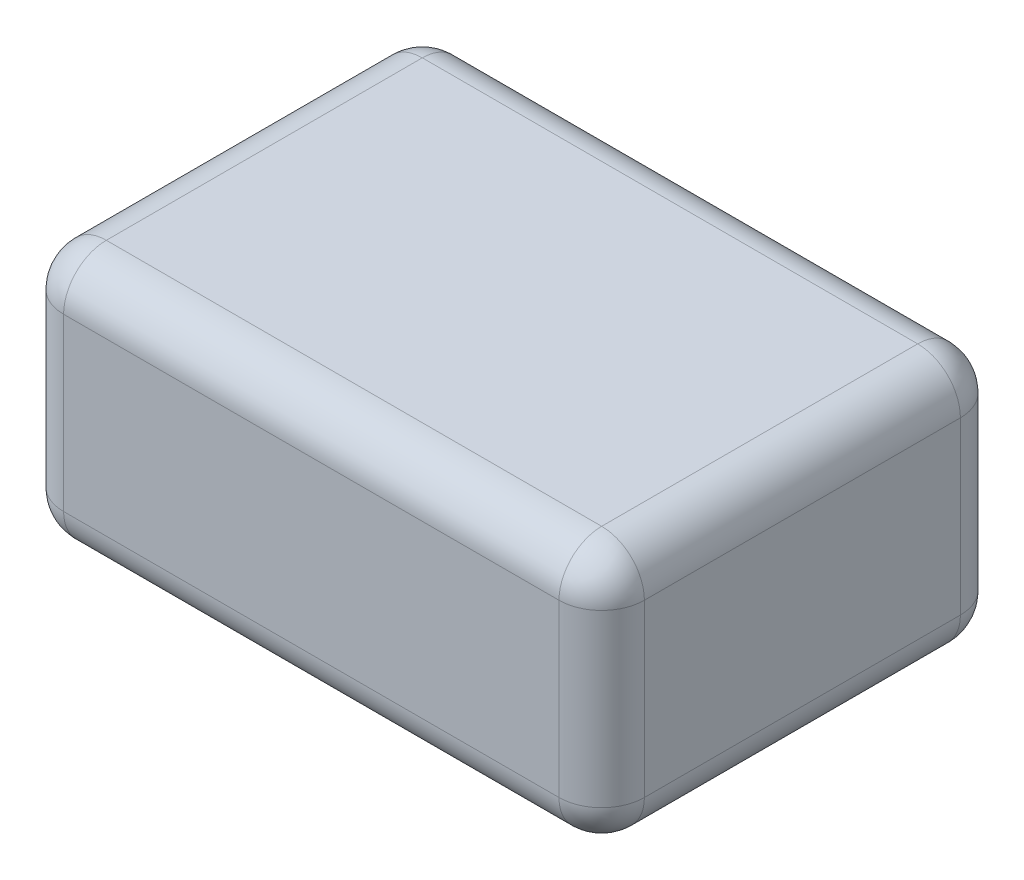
SolidWorks part; units mm, degrees
ref_plane "Plan de face" through (0, 0, 0) normal (0, 0, 1) x (1, 0, 0)
ref_plane "Plan de dessus" through (0, 0, 0) normal (0, 1, 0) x (1, 0, 0)
ref_plane "Plan de droite" through (0, 0, 0) normal (1, 0, 0) x (0, 0, -1)
sketch "Esq_plaque" plane through (0, 0, 0) normal (0, 0, 1) x (1, 0, 0)
  line L1 (0, 0) -> (68, 0)
  line L2 (0, 0) -> (0, 30)
  line L3 (0, 30) -> (68, 30)
  line L4 (68, 0) -> (68, 30)
  dimension "larg" = 30
  dimension "long" = 68
extrude "plaque" add sketch "Esq_plaque" along normal blind 47
fillet "Congé_pièce" radius 5 12 edges at (0, 0, 23.5) (68, 0, 23.5) (68, 30, 23.5) (0, 30, 23.5) (34, 30, 47) (68, 15, 47) (34, 0, 47) (0, 15, 47) (34, 0, 0) (68, 15, 0) (34, 30, 0) (0, 15, 0)
